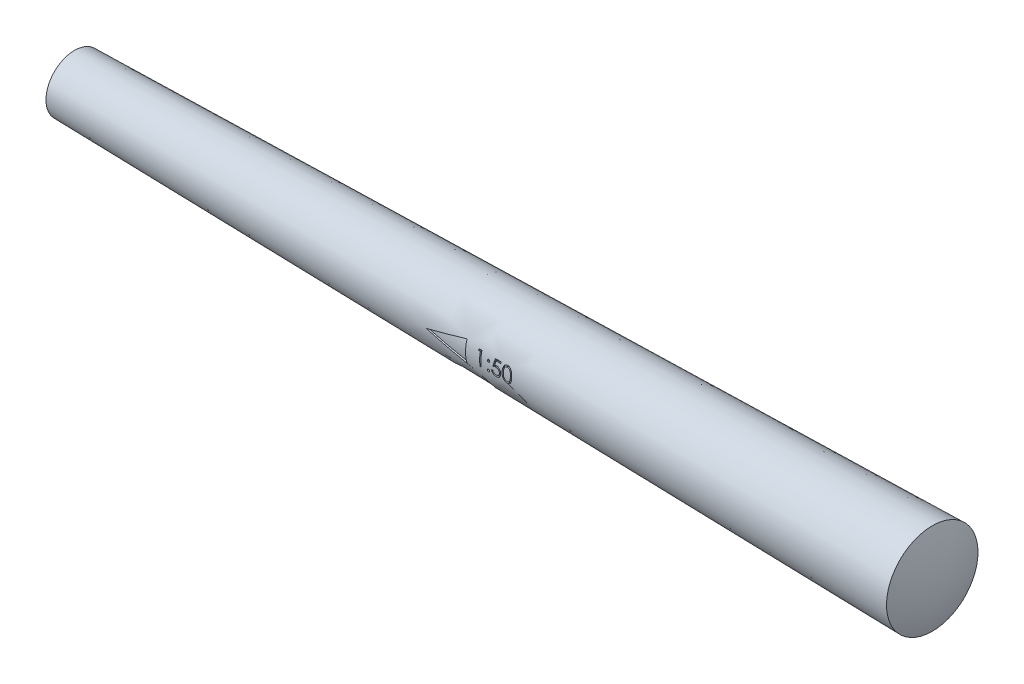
SolidWorks part; units mm, degrees
ref_plane "Front Plane" through (0, 0, 0) normal (0, 0, 1) x (1, 0, 0)
ref_plane "Top Plane" through (0, 0, 0) normal (0, 1, 0) x (1, 0, 0)
ref_plane "Right Plane" through (0, 0, 0) normal (1, 0, 0) x (0, 0, -1)
sketch "Sketch1" plane through (0, 0, 0) normal (1, 0, 0) x (0, 0, -1)
  circle A0 centre (0, 0) radius 2
  dimension "D1" = 4
extrude "Extrude1" add sketch "Sketch1" along normal mid plane 60
draft "Draft1" type of draft neutral plane draft angle 1.146 faces to draft 1 parameters "D1"=1.146
sketch "Sketch2" plane through (0, 0, 0) normal (0, 0, 1) x (1, 0, 0)
  line L0 (-30, 0) -> (-30, 2)
  line L1 (-30, 2) -> (-30, -2) construction
  line L2 (-30, 0) -> (-30.6, 0)
  line L3 (-30.6, 0) -> (-30.6, -2.6) construction
  line L4 (30, 0) -> (30, 3.2)
  line L5 (30, -3.2) -> (30, 3.2) construction
  line L6 (30, 0) -> (30.6, 0)
  line L7 (30.6, 0) -> (30.6, -2.6) construction
  line L8 (-30, -2) -> (30, -3.2) construction
  arc A0 (-30.6, 0) -> (-30, 2) centre (-26.9667, 0) cw
  arc A1 (30.6, 0) -> (30, 3.2) centre (21.7665, 0) ccw
  point P14 (0, -2.6)
revolve "Revolve1" add sketch "Sketch2" angle 360 about L2
sketch "Sketch5" plane through (0, 0, 0) normal (0, 0, 1) x (1, 0, 0)
  line L0 (0, 2.6) -> (0, -2.6) construction
  line L1 (30, 3.2) -> (-30, 2) construction
  line L2 (-30, -2) -> (30, -3.2) construction
ref_plane "Plane2" through (0, 0, 0) normal (-0.02, 0, 0.9998) x (0.9998, 0, 0.02)
sketch "Sketch6" plane through (0, 0, 0) normal (-0.02, 0, 0.9998) x (0.9998, 0, 0.02)
  line L0 (0, 0) -> (0, 0.75)
  line L1 (0, 2.6) -> (0, -2.6) construction
  line L2 (0, 0.75) -> (-2.799, 0)
  line L3 (-2.799, 0) -> (0, -0.75)
  line L4 (0, -0.75) -> (0, 0)
  line L5 (0, -0.375) -> (4, -0.375) construction
  text T0 "1:50" font "Century Gothic" height 1
  dimension "D1" = 1.5
  dimension "D2" = 30
  dimension "D3" = 4
wrap "Wrap2" sketch "Sketch6" wrap type deboss source sketch "Sketch6" thickness 0.1 parameters "D1"=0.1
equation "\"D2@Sketch2\" = \"D1@Sketch2\""
